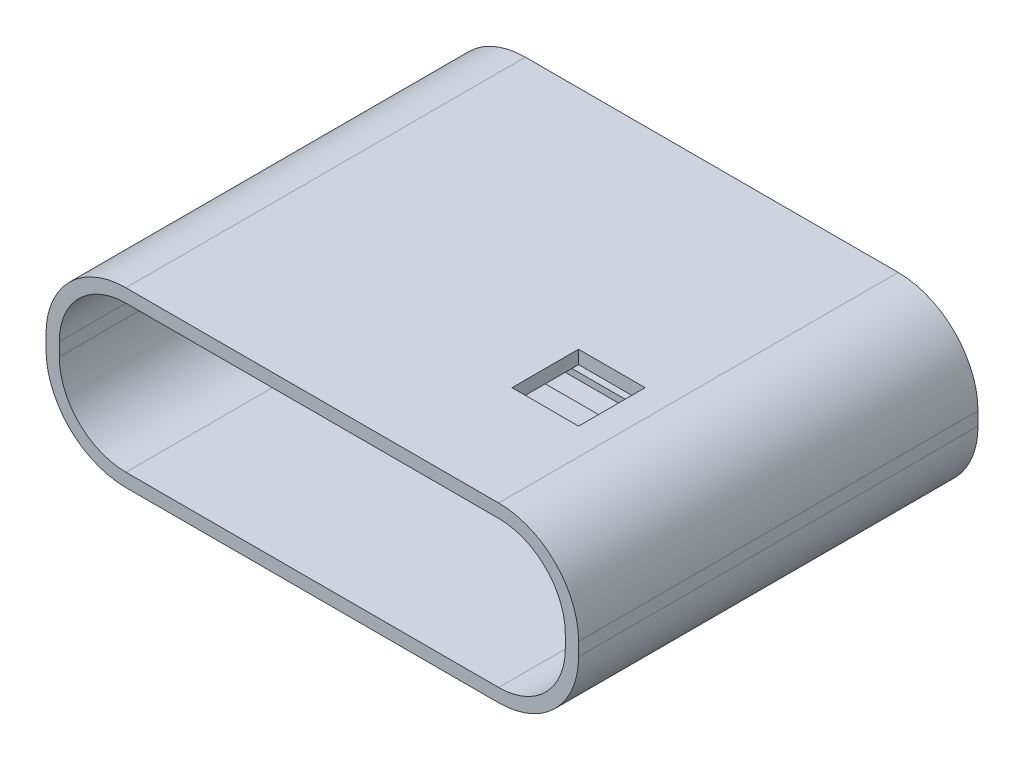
SolidWorks part; units mm, degrees
ref_plane "Plan de face" through (0, 0, 0) normal (0, 0, 1) x (1, 0, 0)
ref_plane "Plan de dessus" through (0, 0, 0) normal (0, 1, 0) x (1, 0, 0)
ref_plane "Plan de droite" through (0, 0, 0) normal (1, 0, 0) x (0, 0, -1)
sketch "Esquisse1" plane through (0, 0, 0) normal (0, 0, 1) x (1, 0, 0)
  line L0 (-45.118, 0) -> (-17.118, 0)
  line L1 (-50.118, 6) -> (-50.118, 5)
  line L2 (-17.118, 11) -> (-45.118, 11)
  line L3 (-12.118, 6) -> (-12.118, 5)
  arc A0 (-45.118, 0) -> (-50.118, 5) centre (-45.118, 5) cw
  arc A1 (-50.118, 6) -> (-45.118, 11) centre (-45.118, 6) cw
  arc A2 (-17.118, 11) -> (-12.118, 6) centre (-17.118, 6) cw
  arc A3 (-17.118, 0) -> (-12.118, 5) centre (-17.118, 5) ccw
  point P6 (-17.118, 5)
  point P7 (-17.118, 6)
  point P9 (-45.118, 5)
extrude "Extru.-Mince2" add sketch "Esquisse1" along normal blind 30 thin
sketch "Esquisse3" plane through (0, 12, 0) normal (0, 1, 0) x (1, 0, 0)
  line L3 (-24.118, -17) -> (-19.118, -17)
  line L4 (-19.118, -17) -> (-19.118, -22)
  line L5 (-19.118, -22) -> (-24.118, -22)
  line L6 (-24.118, -22) -> (-24.118, -17)
extrude "Enlèv. mat.-Extru.1" cut sketch "Esquisse3" against normal blind 1
sketch "Esquisse4" plane through (0, 0, 0) normal (0, 1, 0) x (1, 0, 0)
  line L4 (-25.118, -6.5) -> (-37.118, -6.5)
  line L6 (-25.118, -6.5) -> (-25.118, -8.5)
  line L7 (-25.118, -8.5) -> (-37.118, -8.5)
  line L8 (-37.118, -8.5) -> (-37.118, -6.5)
extrude "Enlèv. mat.-Extru.2" cut sketch "Esquisse4" against normal blind 0.5
